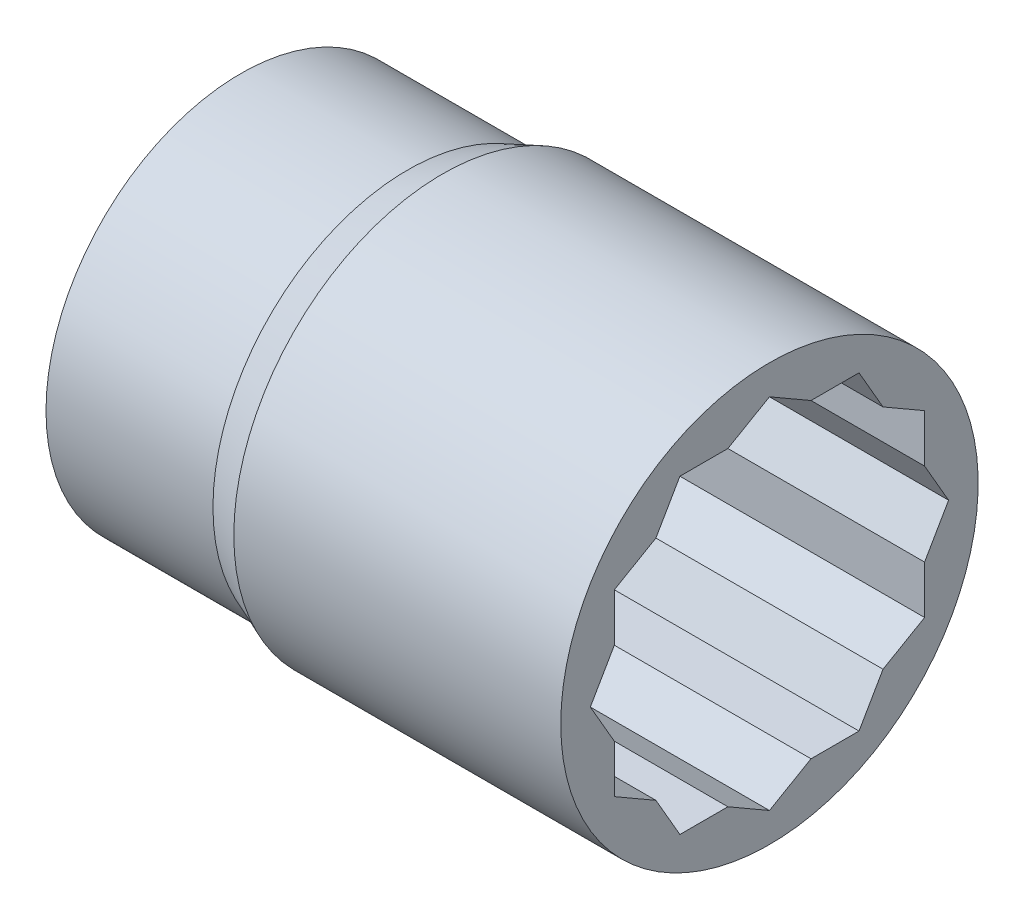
SolidWorks part; units mm, degrees
ref_plane "Face" through (0, 0, 0) normal (0, 0, 1) x (1, 0, 0)
ref_plane "Dessus" through (0, 0, 0) normal (0, 1, 0) x (1, 0, 0)
ref_plane "Droite" through (0, 0, 0) normal (1, 0, 0) x (0, 0, -1)
sketch "Esquisse1" plane through (0, 0, 0) normal (0, 0, 1) x (1, 0, 0)
  line L0 (0, 0) -> (55.117, 0) construction
  line L1 (0, 0) -> (0, 14)
  line L2 (0, 14) -> (12, 14)
  line L3 (12, 14) -> (14.5, 15)
  line L4 (14.5, 15) -> (38, 15)
  line L5 (38, 15) -> (38, 0)
  line L6 (0, 0) -> (38, 0)
  dimension "D1" = 30
  dimension "D2" = 28
  dimension "D3" = 38
  dimension "D4" = 23.5
  dimension "D5" = 12
revolve "Révolution1" add sketch "Esquisse1" angle 360 about L0
sketch "Esquisse2" plane through (0, 0, 0) normal (-1, 0, 0) x (0, 0, 1)
  line L1 (-6, 6) -> (6, 6)
  line L2 (-6, 6) -> (-6, -6)
  line L3 (-6, -6) -> (6, -6)
  line L4 (6, 6) -> (6, -6)
  dimension "D1" = 12
  dimension "D2" = 12
  dimension "D3" = 6
  dimension "D4" = 6
extrude "Enlèv. mat.-Extru.1" cut sketch "Esquisse2" against normal through all
sketch "Esquisse3" plane through (38, 0, 0) normal (1, 0, 0) x (0, 0, -1)
  line L0 (11.15, 6.4375) -> (8.1624, 8.1624)
  line L1 (-12.8749, 0) -> (-11.15, -2.9876)
  line L2 (-6.4375, -11.15) -> (-2.9876, -11.15)
  line L3 (6.4375, -11.15) -> (8.1624, -8.1624)
  line L4 (12.8749, 0) -> (11.15, 2.9876)
  line L5 (6.4375, 11.15) -> (2.9876, 11.15)
  line L6 (-6.4375, 11.15) -> (-8.1624, 8.1624)
  line L7 (0, -12.8749) -> (2.9876, -11.15)
  line L8 (-11.15, 6.4375) -> (-11.15, 2.9876)
  line L9 (-11.15, -6.4375) -> (-8.1624, -8.1624)
  line L10 (0, 12.8749) -> (-2.9876, 11.15)
  line L11 (11.15, -6.4375) -> (11.15, -2.9876)
  line L12 (2.9876, 11.15) -> (0, 12.8749)
  line L13 (-2.9876, 11.15) -> (-6.4375, 11.15)
  line L14 (-8.1624, 8.1624) -> (-11.15, 6.4375)
  line L15 (-11.15, 2.9876) -> (-12.8749, 0)
  line L16 (-11.15, -2.9876) -> (-11.15, -6.4375)
  line L17 (-8.1624, -8.1624) -> (-6.4375, -11.15)
  line L18 (-2.9876, -11.15) -> (0, -12.8749)
  line L19 (2.9876, -11.15) -> (6.4375, -11.15)
  line L20 (8.1624, -8.1624) -> (11.15, -6.4375)
  line L21 (11.15, -2.9876) -> (12.8749, 0)
  line L22 (11.15, 2.9876) -> (11.15, 6.4375)
  line L23 (8.1624, 8.1624) -> (6.4375, 11.15)
  circle A0 centre (0, 0) radius 11.15 construction
  dimension "D1" = 22.3
extrude "Enlèv. mat.-Extru.2" cut sketch "Esquisse3" against normal blind 20
